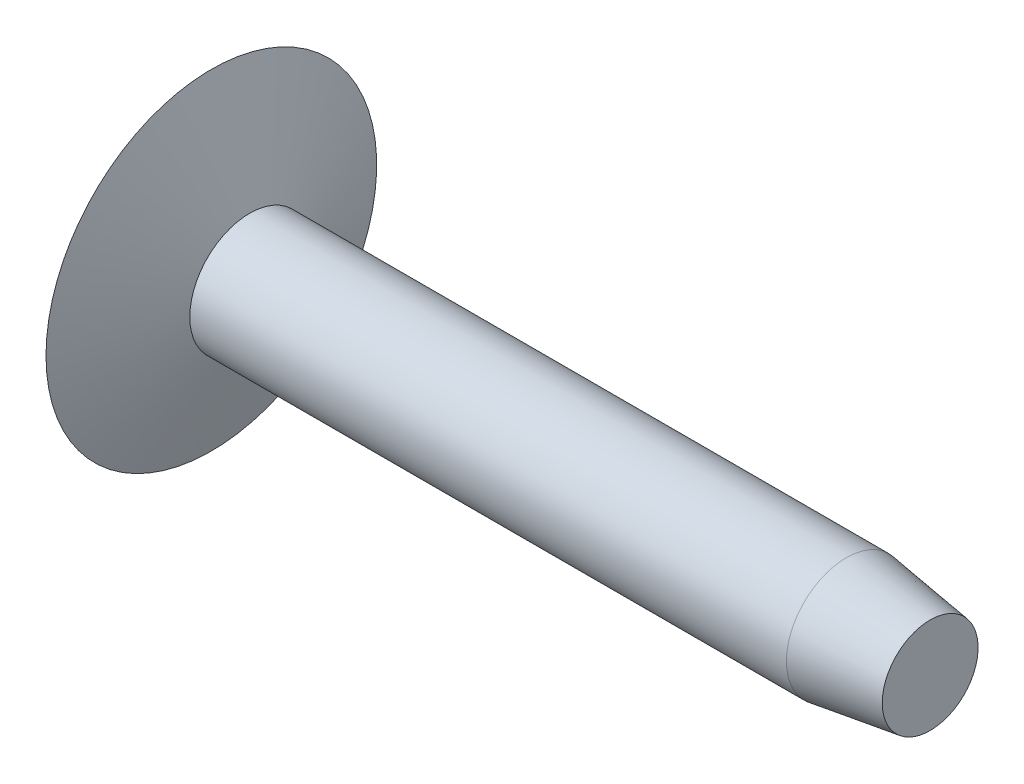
SolidWorks part; units mm, degrees
ref_plane "Plane1" through (0, 0, 0) normal (0, 0, 1) x (1, 0, 0)
ref_plane "Plane2" through (0, 0, 0) normal (0, 1, 0) x (1, 0, 0)
ref_plane "Plane3" through (0, 0, 0) normal (1, 0, 0) x (0, 0, -1)
other "Configuration Table"
sketch "Sketch1" plane through (0, 0, 0) normal (0, 0, 1) x (1, 0, 0)
  line L0 (0, 0) -> (45, 0) construction
  line L1 (0, 0) -> (0, 6.9)
  line L2 (0, 6.9) -> (1.6015, 2.5)
  line L3 (1.6015, 2.5) -> (26.5, 2.5)
  line L4 (26.5, 2.5) -> (30, 2)
  line L5 (30, 2) -> (30, 0)
  line L6 (30, 0) -> (0, 0)
  line L7 (0, -6.9) -> (1.6015, -2.5) construction
  dimension "D1" = 140
  dimension "Diameter" = 5
  dimension "PilotDia" = 4
  dimension "PilotLength" = 3.5
  dimension "HeadDia" = 13.8
  dimension "Length" = 30
revolve "Base-Revolve" add sketch "Sketch1" angle 360 about L0
